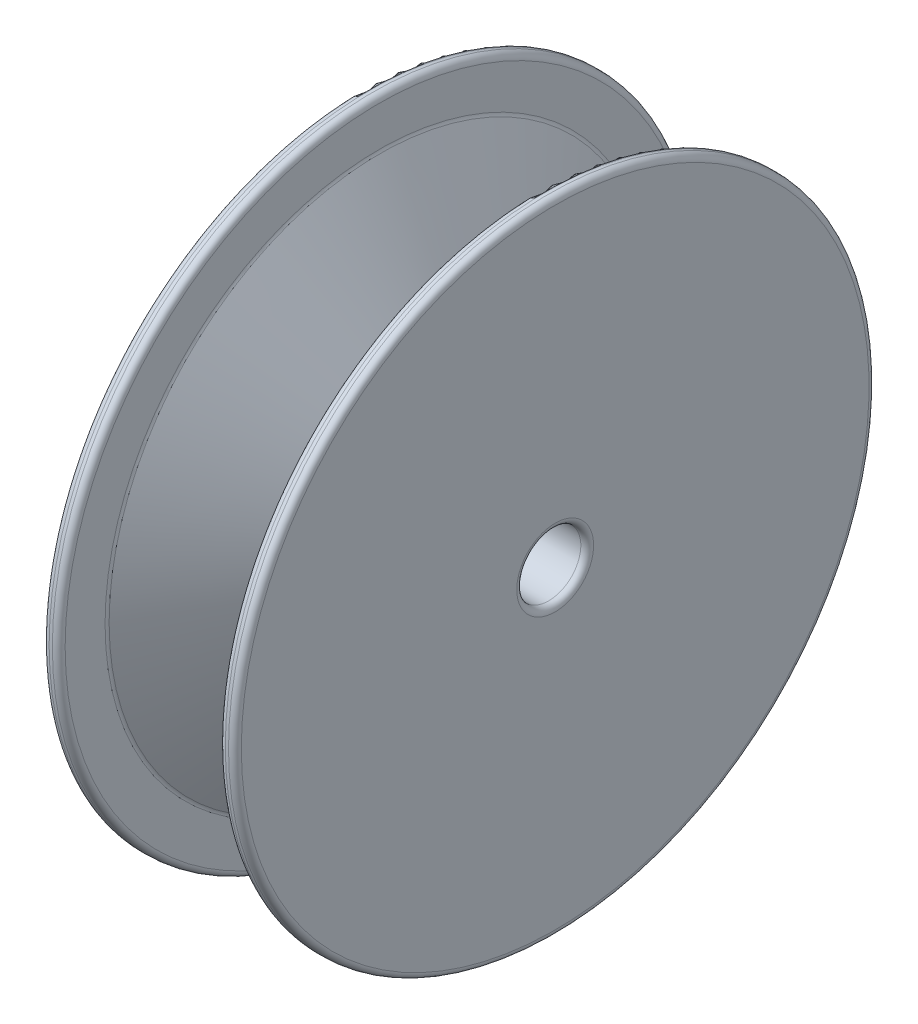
SolidWorks part; units mm, degrees
ref_plane "Face" through (0, 0, 0) normal (0, 0, 1) x (1, 0, 0)
ref_plane "Dessus" through (0, 0, 0) normal (0, 1, 0) x (1, 0, 0)
ref_plane "Droite" through (0, 0, 0) normal (1, 0, 0) x (0, 0, -1)
sketch "Esquisse1" plane through (0, 0, 0) normal (0, 0, 1) x (1, 0, 0)
  line L1 (-2.5, 8.5) -> (0, 4.1699)
  line L3 (3, 1) -> (3, 10)
  line L4 (-3, 10) -> (-2.5, 10)
  line L5 (-3, 1) -> (-3, 10)
  line L6 (0, 4.1699) -> (2.5, 8.5)
  line L7 (-2.5, 10) -> (-2.5, 8.5)
  line L8 (2.5, 8.5) -> (2.5, 10)
  line L9 (3, 10) -> (2.5, 10)
  line L10 (-3, 1) -> (3, 1)
  line L12 (0, 0) -> (68.6205, 0) construction
  dimension "D8" = 2.5
  dimension "D1" = 3
  dimension "D2" = 6
  dimension "D3" = 1.5
  dimension "D4" = 0.5
  dimension "D5" = 0.5
  dimension "D6" = 1
  dimension "D7" = 30
  dimension "D9" = 30
  dimension "D10" = 20
revolve "Révolution2" add sketch "Esquisse1" angle 360 about L12
fillet "Congé1" radius 0.2 9 edges at (2.5, 0, 10) (2.5, 0, 8.5) (0, 0, 4.1699) (-2.5, 0, 8.5) (-2.5, 0, 10) (3, 0, 1) (3, 0, 10) (-3, 0, 10) (-3, 0, 1)
sketch "Esquisse2" plane through (-3, 0, 0) normal (-1, 0, 0) x (0, 0, 1)
  line L0 (0, 0) -> (15.6118, 0) construction
  circle A0 centre (0, 6.53) radius 0.8434
  circle A1 centre (0, -6.53) radius 0.8434
extrude "Enlèv. mat.-Extru.1" cut sketch "Esquisse2" against normal blind 0.25
